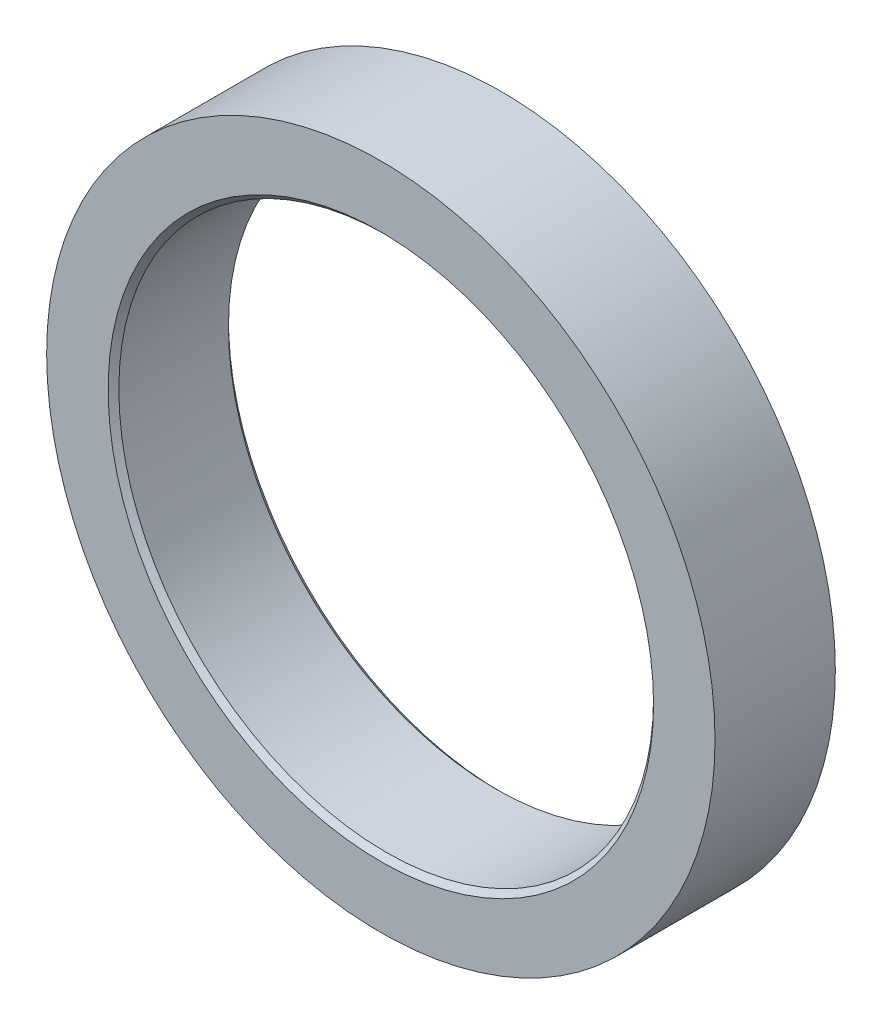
SolidWorks part; units mm, degrees
ref_plane "Plan de face" through (0, 0, 0) normal (0, 0, 1) x (1, 0, 0)
ref_plane "Plan de dessus" through (0, 0, 0) normal (0, 1, 0) x (1, 0, 0)
ref_plane "Plan de droite" through (0, 0, 0) normal (1, 0, 0) x (0, 0, -1)
sketch "Esquisse1" plane through (0, 0, 0) normal (0, 0, 1) x (1, 0, 0)
  circle A0 centre (0, 0) radius 10
  circle A1 centre (0, 0) radius 12.5
  dimension "D1" = 20
  dimension "D2" = 25
extrude "Extrusion1" add sketch "Esquisse1" along normal blind 4.5
chamfer "Chanfrein1" distance 0.2 angle 45 2 edges at (10, 0, 0) (10, 0, 4.5)
